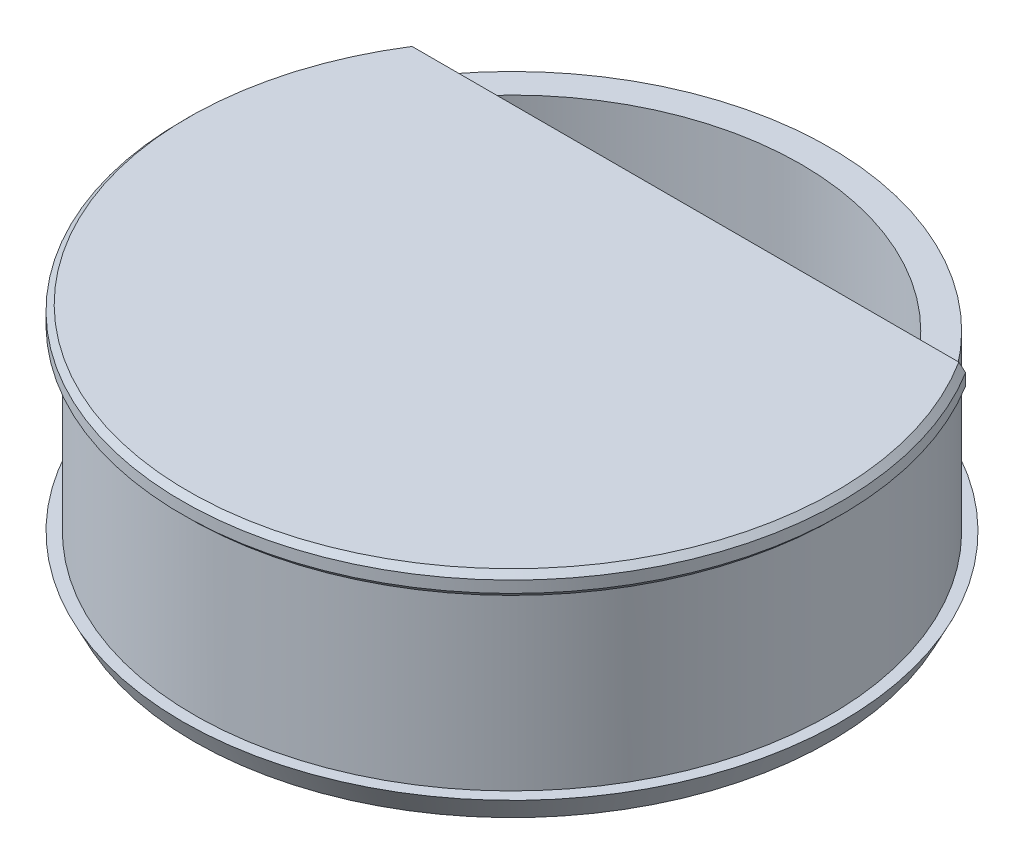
SolidWorks part; units mm, degrees
ref_plane "Front Plane" through (0, 0, 0) normal (0, 0, 1) x (1, 0, 0)
ref_plane "Top Plane" through (0, 0, 0) normal (0, 1, 0) x (1, 0, 0)
ref_plane "Right Plane" through (0, 0, 0) normal (1, 0, 0) x (0, 0, -1)
sketch "Sketch1" plane through (0, 0, 0) normal (0, 1, 0) x (1, 0, 0)
  circle A0 centre (0, 0) radius 28.5
  dimension "D1" = 57
extrude "Boss-Extrude1" add sketch "Sketch1" along normal blind 2
sketch "Sketch2" plane through (0, 0, 0) normal (0, -1, 0) x (1, 0, 0)
  circle A0 centre (0, 0) radius 27.5
  circle A1 centre (0, 0) radius 25
  dimension "D1" = 55
  dimension "D2" = 50
extrude "Boss-Extrude2" add sketch "Sketch2" along normal blind 15
sketch "Sketch3" plane through (0, 0, 0) normal (1, 0, 0) x (0, 0, -1)
  line L0 (-28.5, -15) -> (0, -15) construction
  line L1 (-27.5, -15) -> (27.5, -15) construction
  line L2 (0, -15) -> (0, -17) construction
  line L3 (0, -17) -> (-27.5, -17) construction
  line L4 (-27.5, -17) -> (-28.5, -15)
  line L5 (-28.5, 2) -> (-28.5, 0) construction
  line L7 (-27.5, 0) -> (-27.5, -15) construction
  line L9 (-25, -17) -> (-25, -15)
  line L10 (-25, -15) -> (25, -15) construction
  line L11 (-28.5, -15) -> (-25, -15)
  line L12 (-27.5, -17) -> (-25, -17)
  dimension "D1" = 2
revolve "Revolve1" add sketch "Sketch3" angle 360 about L2
sketch "Sketch4" plane through (0, 2, 0) normal (0, 1, 0) x (1, 0, 0)
  line L1 (-24.2332, 28.5) -> (24.2332, 28.5)
  line L2 (-24.2332, 28.5) -> (-24.2332, 15)
  line L3 (-24.2332, 15) -> (24.2332, 15)
  line L4 (24.2332, 28.5) -> (24.2332, 15)
  circle A0 centre (0, 0) radius 28.5 construction
  dimension "D1" = 15
extrude "Cut-Extrude1" cut sketch "Sketch4" against normal blind 2
chamfer "Chamfer1" distance 0.5 angle 45 3 edges at (0, 2, 28.5) (0, -17, 25) (0, 0, 28.5)
